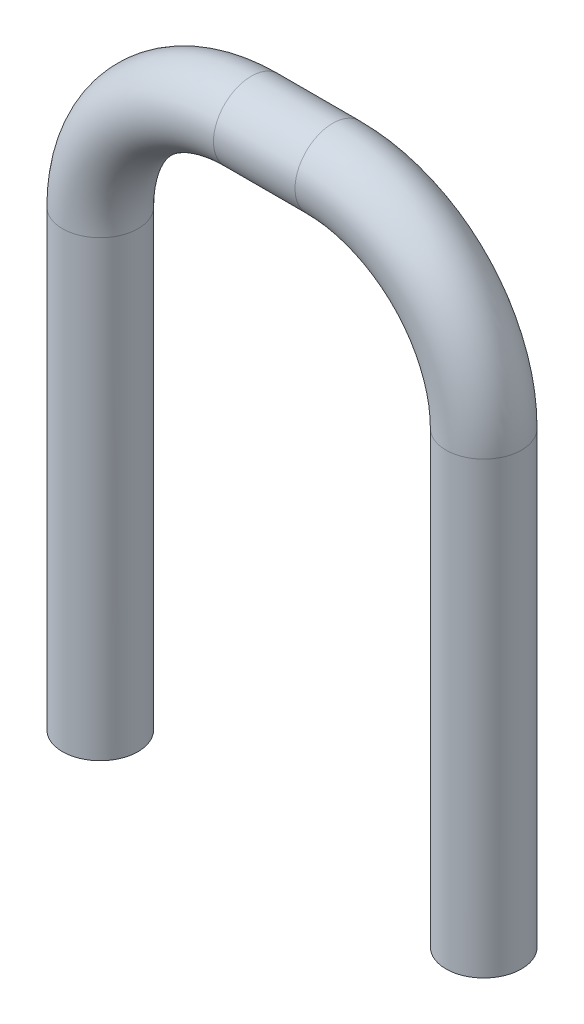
SolidWorks part; units mm, degrees
ref_plane "Plan de face" through (0, 0, 0) normal (0, 0, 1) x (1, 0, 0)
ref_plane "Plan de dessus" through (0, 0, 0) normal (0, 1, 0) x (1, 0, 0)
ref_plane "Plan de droite" through (0, 0, 0) normal (1, 0, 0) x (0, 0, -1)
sketch "Esquisse1" plane through (0, 0, 0) normal (0, 0, 1) x (1, 0, 0)
  line L0 (0, 0) -> (0, 3)
  line L1 (1, 4) -> (1.54, 4)
  line L2 (2.54, 3) -> (2.54, 0.0237)
  arc A0 (1.54, 4) -> (2.54, 3) centre (1.54, 3) cw
  arc A1 (0, 3) -> (1, 4) centre (1, 3) cw
  point P7 (2.54, 4)
  point P10 (0, 4)
  dimension "D3" = 1
  dimension "D1" = 2.54
  dimension "D2" = 4
sketch "Esquisse2" plane through (0, 0, 0) normal (0, 1, 0) x (1, 0, 0)
  circle A0 centre (0, 0) radius 0.25
  dimension "D1" = 0.5
sweep "Balayage1" add profiles "Esquisse2" path "Esquisse1"
